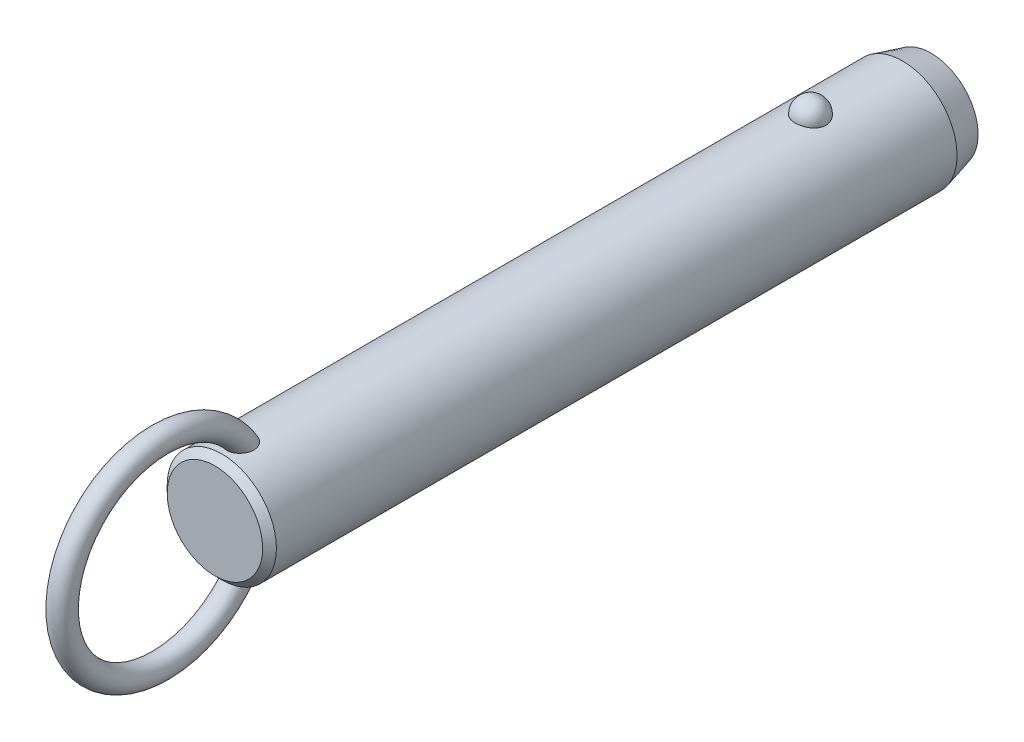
SolidWorks part; units mm, degrees
ref_plane "Front Plane" through (0, 0, 0) normal (0, 0, 1) x (1, 0, 0)
ref_plane "Top Plane" through (0, 0, 0) normal (0, 1, 0) x (1, 0, 0)
ref_plane "Right Plane" through (0, 0, 0) normal (1, 0, 0) x (0, 0, -1)
sketch "Sketch2" plane through (0, 0, 0) normal (0, 0, 1) x (1, 0, 0)
  circle A0 centre (0, 0) radius 9.5
  point P3 (0, 9.5)
  dimension "D1" = 19
extrude "Boss-Extrude1" add sketch "Sketch2" along normal blind 91.4
sketch "Sketch3" plane through (0, 0, 0) normal (0, 0, -1) x (-1, 0, 0)
  circle A0 centre (0, 0) radius 9.5
  dimension "D1" = 19
extrude "Boss-Extrude2" add sketch "Sketch3" along normal blind 23.7
chamfer "Chamfer1" distance 5 angle 15 1 edges at (-9.5, 0, -23.7)
sketch "Sketch12" plane through (0, 0, 0) normal (1, 0, 0) x (0, 0, -1)
  line L0 (-91.4, 9.5) -> (-91.4, -9.5) construction
  point P0 (-91.4, 0)
sketch "Sketch13" plane through (0, 0, 0) normal (1, 0, 0) x (0, 0, -1)
  circle A0 centre (-110.45, 0) radius 19.05
  point P2 (-91.4, 0)
  dimension "D1" = 38.1
sketch "Sketch14" plane through (0, 0, 0) normal (0, 1, 0) x (1, 0, 0)
  circle A0 centre (0, -93.4) radius 2
  point P2 (0, -91.4)
  dimension "D1" = 4
sweep "Sweep1" add profiles "Sketch14" path "Sketch13"
sketch "Sketch15" plane through (0, 0, 91.4) normal (0, 0, 1) x (1, 0, 0)
  circle A0 centre (0, 0) radius 9.5
  dimension "D1" = 19
extrude "Boss-Extrude3" add sketch "Sketch15" along normal blind 9.52
chamfer "Chamfer2" distance 1.2 angle 45 1 edges at (9.5, 0, 100.92)
sketch "Sketch18" plane through (0, 0, 0) normal (1, 0, 0) x (0, 0, -1)
  line L0 (18.7, 9.5) -> (-93.9378, 9.5) construction
  line L1 (2.7, 12.2) -> (2.7, 6.8)
  line L2 (-93.9378, -9.5) -> (18.7, -9.5) construction
  arc A0 (2.7, 12.2) -> (2.7, 6.8) centre (2.7, 9.5) ccw
  point P4 (0, 9.5)
  dimension "D1" = 21.7
revolve "Revolve1" add sketch "Sketch18" angle 360 about L1
